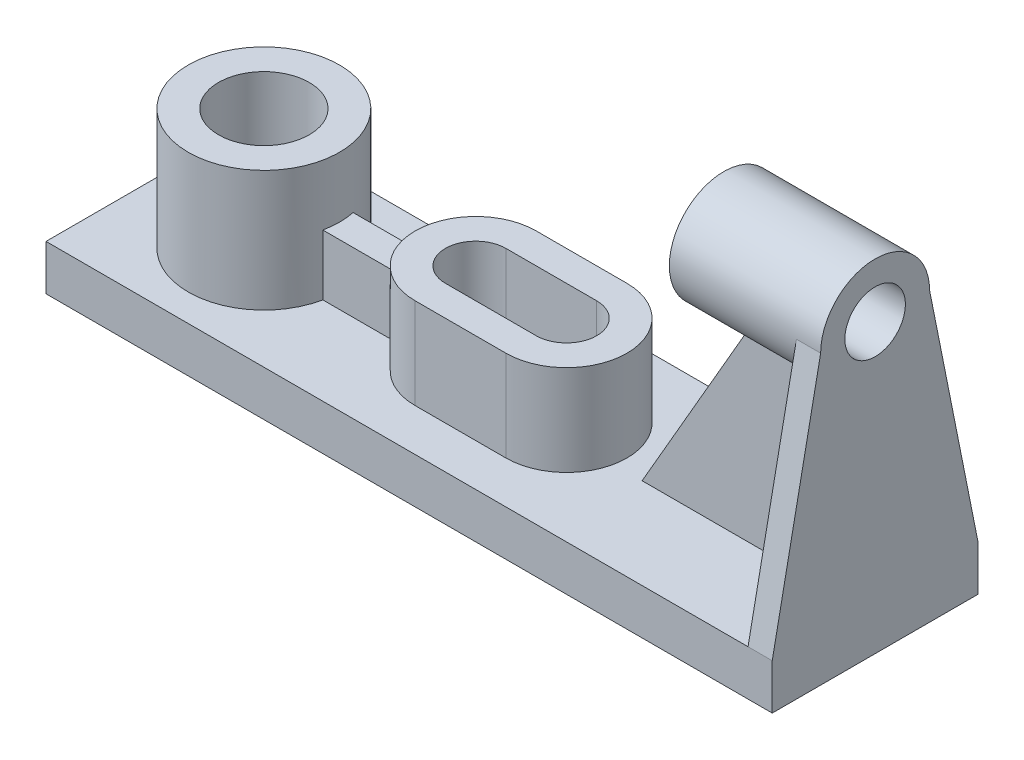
SolidWorks part; units mm, degrees
ref_plane "Front Plane" through (0, 0, 0) normal (0, 0, 1) x (1, 0, 0)
ref_plane "Top Plane" through (0, 0, 0) normal (0, 1, 0) x (1, 0, 0)
ref_plane "Right Plane" through (0, 0, 0) normal (1, 0, 0) x (0, 0, -1)
sketch "Sketch2" plane through (0, 0, 0) normal (0, 1, 0) x (1, 0, 0)
  line L1 (-120, 34) -> (120, 34)
  line L2 (-120, 34) -> (-120, -34)
  line L3 (-120, -34) -> (120, -34)
  line L4 (120, 34) -> (120, -34)
  line L5 (-120, 34) -> (120, -34) construction
  line L6 (-120, -34) -> (120, 34) construction
  point P0 (0, 0)
  dimension "D1" = 240
  dimension "D2" = 68
extrude "Boss-Extrude1" add sketch "Sketch2" along normal blind 15
sketch "Sketch4" plane through (0, 15, 0) normal (0, 1, 0) x (1, 0, 0)
  line L3 (120, -34) -> (120, 34) construction
  circle A0 centre (-82, 0) radius 25
  circle A5 centre (-82, 0) radius 15
  dimension "D3" = 50
  dimension "D7" = 30
  dimension "D1" = 202
extrude "Boss-Extrude4" add sketch "Sketch4" along normal blind 40 contours A5 | A0
sketch "Sketch7" plane through (0, 15, 0) normal (0, 1, 0) x (1, 0, 0)
  circle A0 centre (-82, 0) radius 15
extrude "Cut-Extrude2" cut sketch "Sketch7" against normal blind 40
sketch "Sketch8" plane through (0, 15, 0) normal (0, 1, 0) x (1, 0, 0)
  line L0 (-12, 0) -> (18, 0) construction
  line L1 (-12, 20) -> (18, 20)
  line L2 (-12, -20) -> (18, -20)
  line L3 (120, -34) -> (120, 34) construction
  line L4 (-12, 10) -> (18, 10)
  line L5 (-12, -10) -> (18, -10)
  arc A0 (-12, 20) -> (-12, -20) centre (-12, 0) ccw
  arc A1 (18, -20) -> (18, 20) centre (18, 0) ccw
  arc A2 (18, -10) -> (18, 10) centre (18, 0) ccw
  arc A3 (-12, 10) -> (-12, -10) centre (-12, 0) ccw
  point P4 (3, 0)
  dimension "D1" = 20
  dimension "D2" = 30
  dimension "D3" = 132
  dimension "D4" = 10
extrude "Boss-Extrude5" add sketch "Sketch8" along normal blind 30 contours L2 A1 L1 A0
sketch "Sketch9" plane through (0, 45, 0) normal (0, 1, 0) x (1, 0, 0)
  line L4 (-12, -10) -> (18, -10)
  line L5 (18, 10) -> (-12, 10)
  line L6 (-12, -10) -> (18, -10)
  line L7 (18, 10) -> (-12, 10)
  arc A4 (-12, 10) -> (-12, -10) centre (-12, 0) ccw
  arc A5 (18, -10) -> (18, 10) centre (18, 0) ccw
  arc A6 (-12, 10) -> (-12, -10) centre (-12, 0) ccw
  arc A7 (18, -10) -> (18, 10) centre (18, 0) ccw
  dimension "D1" = 10
extrude "Cut-Extrude3" cut sketch "Sketch9" against normal blind 77
sketch "Sketch11" plane through (0, 0, 0) normal (0, 0, 1) x (1, 0, 0)
  line L0 (-57, 35) -> (-32, 35)
  line L1 (-57, 15) -> (-57, 55) construction
  line L2 (-32, 45) -> (-32, 15) construction
  line L3 (-120, 15) -> (120, 15) construction
  dimension "D1" = 20
rib "Rib3" sketch "Sketch11" sketch "Sketch11" thickness 10 extrusion direction parallel to sketch draft on no parameters "D1"=10
sketch "Sketch12" plane through (120, 0, 0) normal (1, 0, 0) x (0, 0, -1)
  line L0 (0, 15) -> (0, 95) construction
  line L1 (-34, 15) -> (34, 15) construction
  line L2 (-18, 95) -> (-34, 15)
  line L3 (18, 95) -> (34, 15)
  line L4 (-34, 15) -> (34, 15)
  arc A0 (18, 95) -> (-18, 95) centre (0, 95) ccw
  dimension "D1" = 36
  dimension "D2" = 95
extrude "Boss-Extrude6" add sketch "Sketch12" against normal blind 8
sketch "Sketch13" plane through (112, 0, 0) normal (-1, 0, 0) x (0, 0, 1)
  circle A0 centre (0, 95) radius 18
extrude "Boss-Extrude7" add sketch "Sketch13" along normal blind 42
sketch "Sketch14" plane through (70, 0, 0) normal (-1, 0, 0) x (0, 0, 1)
  circle A0 centre (0, 95) radius 10
  dimension "D1" = 20
extrude "Cut-Extrude4" cut sketch "Sketch14" against normal blind 67
sketch "Sketch19" plane through (0, 0, 0) normal (0, 0, 1) x (1, 0, 0)
  line L6 (82.7957, 77) -> (47, 15)
  line L7 (70, 77) -> (112, 77) construction
  line L8 (-120, 15) -> (112, 15) construction
  dimension "D1" = 65
  dimension "D2" = 60
rib "Rib14" sketch "Sketch19" sketch "Sketch19" thickness 8 extrusion direction parallel to sketch draft on no parameters "D1"=8
